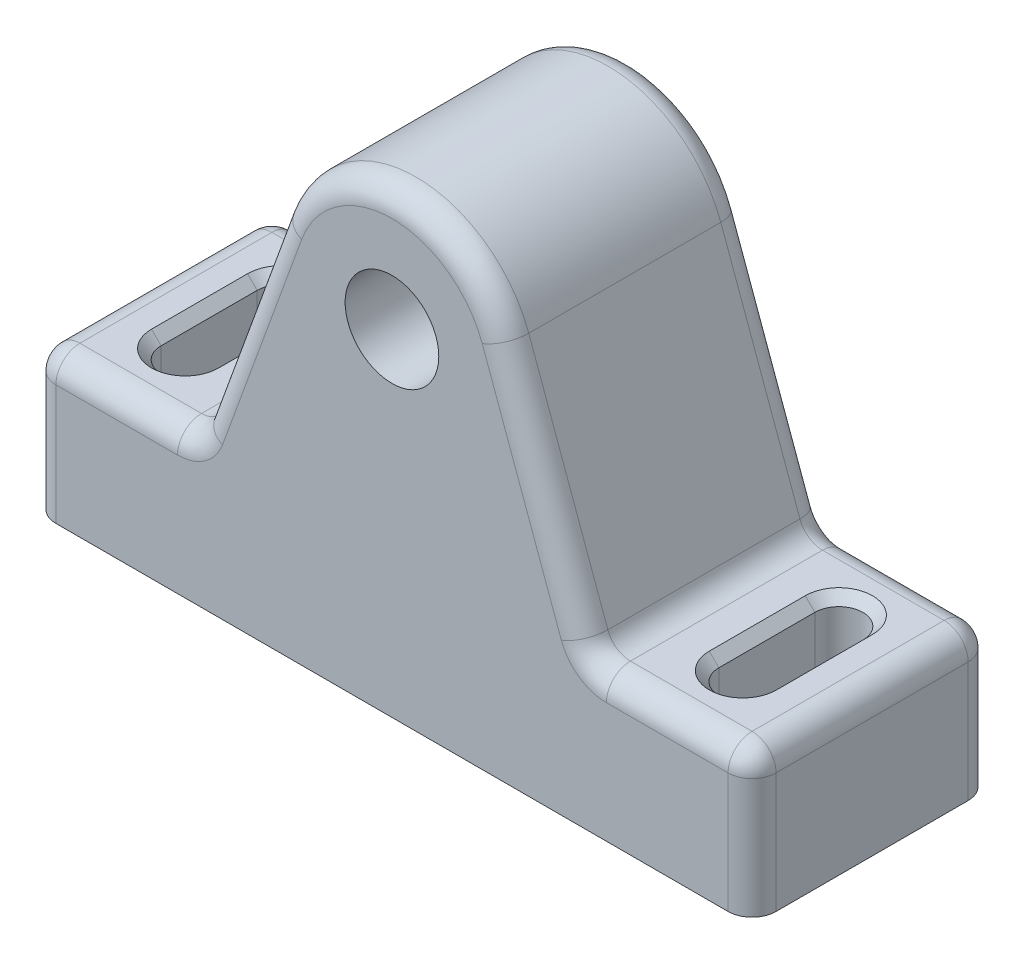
SolidWorks part; units mm, degrees
ref_plane "Plan de face" through (0, 0, 0) normal (0, 0, 1) x (1, 0, 0)
ref_plane "Plan de dessus" through (0, 0, 0) normal (0, 1, 0) x (1, 0, 0)
ref_plane "Plan de droite" through (0, 0, 0) normal (1, 0, 0) x (0, 0, -1)
sketch "Esquisse1" plane through (0, 0, 0) normal (0, 0, 1) x (1, 0, 0)
  line L0 (75, 0) -> (-75, 0)
  line L1 (-75, 0) -> (-75, 30)
  line L2 (-75, 30) -> (-41.1633, 30)
  line L3 (-41.1633, 30) -> (-23.4923, 78.5505)
  line L4 (0, 95) -> (0, 0) construction
  line L5 (75, 0) -> (75, 30)
  line L6 (75, 30) -> (41.1633, 30)
  line L7 (41.1633, 30) -> (23.4923, 78.5505)
  arc A0 (-23.4923, 78.5505) -> (23.4923, 78.5505) centre (0, 70) cw
  circle A1 centre (0, 70) radius 9.75
  dimension "D1" = 30
  dimension "D2" = 25
  dimension "D6" = 19.5
  dimension "D3" = 20
  dimension "D4" = 70
  dimension "D5" = 150
extrude "Boss.-Extru.1" add sketch "Esquisse1" along normal mid plane 50
sketch "Esquisse2" plane through (0, 30, 0) normal (0, 1, 0) x (1, 0, 0)
  line L0 (-58.0816, -10) -> (-58.0816, 10) construction
  line L1 (-63.0816, -10) -> (-63.0816, 10)
  line L2 (-53.0816, -10) -> (-53.0816, 10)
  line L4 (-41.1633, 25) -> (-75, 25) construction
  line L5 (-41.1633, 25) -> (-75, 25) construction
  line L6 (0, 25) -> (0, -25) construction
  line L7 (23.4923, 25) -> (-23.4923, 25) construction
  line L8 (-23.4923, -25) -> (23.4923, -25) construction
  line L9 (58.0816, -10) -> (58.0816, 10) construction
  line L10 (63.0816, -10) -> (63.0816, 10)
  line L11 (53.0816, -10) -> (53.0816, 10)
  arc A0 (-63.0816, -10) -> (-53.0816, -10) centre (-58.0816, -10) ccw
  arc A1 (-53.0816, 10) -> (-63.0816, 10) centre (-58.0816, 10) ccw
  arc A2 (63.0816, -10) -> (53.0816, -10) centre (58.0816, -10) cw
  arc A3 (53.0816, 10) -> (63.0816, 10) centre (58.0816, 10) cw
  point P2 (-58.0816, 0)
  point P12 (-58.0816, 25)
  point P19 (58.0816, 0)
  dimension "D2" = 5
  dimension "D1" = 20
extrude "Enlèv. mat.-Extru.1" cut sketch "Esquisse2" against normal through all
fillet "Congé2" radius 5 18 edges at (58.0816, 30, 25) (32.3278, 54.2753, 25) (0, 95, 25) (0, 95, -25) (-32.3278, 54.2753, 25) (-32.3278, 54.2753, -25) (32.3278, 54.2753, -25) (75, 30, 0) (75, 15, 25) (-58.0816, 30, 25) (-75, 15, 25) (-41.1633, 30, 0) (-75, 30, 0) (-58.0816, 30, -25) (-75, 15, -25) (58.0816, 30, -25) (41.1633, 30, 0) (75, 15, -25)
chamfer "Chanfrein2" distance 2 angle 45 8 edges at (-63.0816, 30, 0) (-58.0816, 30, 15) (-58.0816, 30, -15) (-53.0816, 30, 0) (63.0816, 30, 0) (58.0816, 30, -15) (58.0816, 30, 15) (53.0816, 30, 0)
